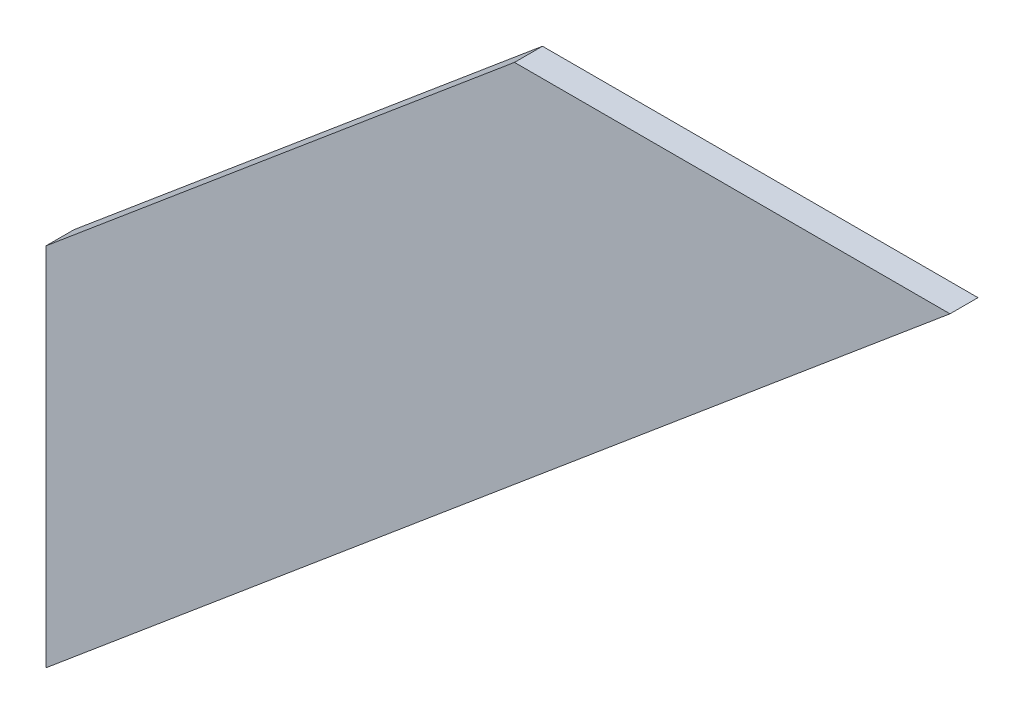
SolidWorks part; units mm, degrees
ref_plane "Ebene vorne" through (0, 0, 0) normal (0, 0, 1) x (1, 0, 0)
ref_plane "Ebene oben" through (0, 0, 0) normal (0, 1, 0) x (1, 0, 0)
ref_plane "Ebene rechts" through (0, 0, 0) normal (1, 0, 0) x (0, 0, -1)
sketch "Skizze1" plane through (0, 0, 0) normal (0, 0, 1) x (1, 0, 0)
  line L0 (-2520, 1057.6619) -> (-2386.1207, 1170)
  line L1 (-2520, 1130) -> (-2520, -1130) construction
  line L2 (2520, 1170) -> (-2520, 1170) construction
  line L3 (-2386.1207, 1170) -> (-2261.6628, 1170)
  line L4 (-2261.6628, 1170) -> (-2520, 953.2293)
  line L5 (-2520, 1057.6619) -> (-2520, 953.2293)
  dimension "D1" = 80
  dimension "D2" = 50
extrude "Aufsatz-Linear austragen1" add sketch "Skizze1" along normal blind 8
